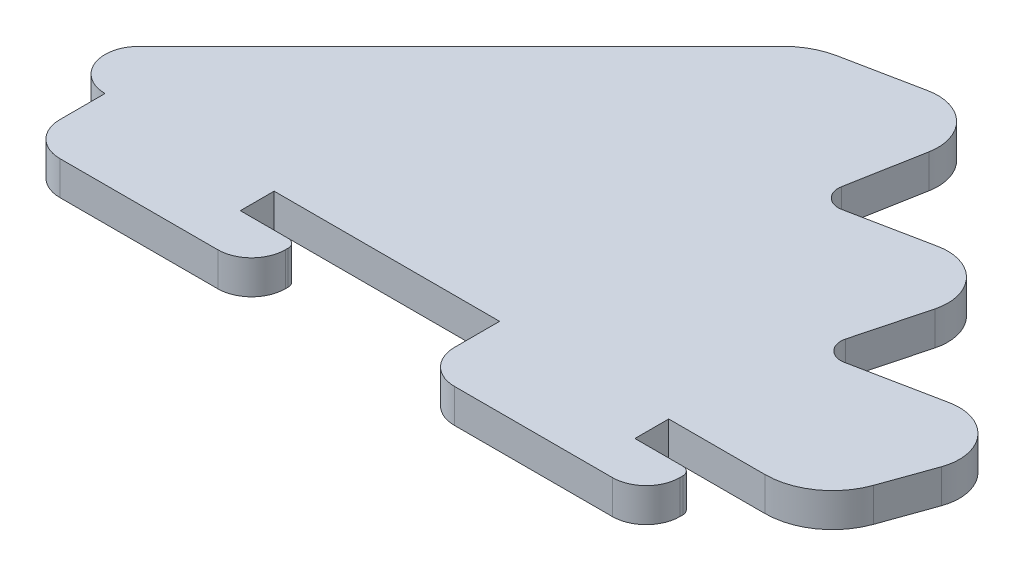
SolidWorks part; units mm, degrees
ref_plane "Front Plane" through (0, 0, 0) normal (0, 0, 1) x (1, 0, 0)
ref_plane "Top Plane" through (0, 0, 0) normal (0, 1, 0) x (1, 0, 0)
ref_plane "Right Plane" through (0, 0, 0) normal (1, 0, 0) x (0, 0, -1)
sketch "Sketch1" plane through (0, 0, 0) normal (0, 1, 0) x (1, 0, 0)
  line L0 (22.2426, 0) -> (42.2426, 0)
  line L1 (-55, 0) -> (55, 0) construction
  line L3 (33.7175, 33.7175) -> (5.1213, 5.1213)
  line L4 (36.7782, 35.3573) -> (43.5415, 36.7163)
  line L5 (48.2644, 32.0759) -> (47.0647, 25.5086)
  line L6 (48.8358, 23.7685) -> (55.9358, 25.1951)
  line L7 (60.5924, 20.2568) -> (58.9457, 13.991)
  line L8 (60.6919, 12.1392) -> (68.4539, 13.6988)
  line L9 (73.0092, 8.4329) -> (71.4215, 3.9835)
  line L10 (57.2426, 0) -> (65.7705, 0)
  line L12 (7.2426, 0) -> (7.2426, -3)
  line L14 (22.2426, 0) -> (22.2426, -3)
  line L15 (22.2426, -3) -> (27.2426, -3)
  line L16 (7.2426, -3) -> (7.2426, -7)
  line L17 (7.2426, -7) -> (27.2426, -7)
  line L18 (27.2426, -3) -> (27.2426, -7)
  line L20 (42.2426, 0) -> (42.2426, -3)
  line L22 (57.2426, 0) -> (57.2426, -3)
  line L23 (57.2426, -3) -> (62.2426, -3)
  line L24 (42.2426, -3) -> (42.2426, -7)
  line L25 (42.2426, -7) -> (62.2426, -7)
  line L26 (62.2426, -3) -> (62.2426, -7)
  arc A3 (68.4539, 13.6988) -> (73.0092, 8.4329) centre (69.2419, 9.7772) cw
  arc A4 (55.9358, 25.1951) -> (60.5924, 20.2568) centre (56.7238, 21.2735) cw
  arc A5 (43.5415, 36.7163) -> (48.2644, 32.0759) centre (44.3295, 32.7947) cw
  arc A6 (33.7175, 33.7175) -> (36.7782, 35.3573) centre (37.9602, 29.4749) cw
  arc A7 (65.7705, 0) -> (71.4215, 3.9835) centre (65.7705, 6) ccw
  arc A8 (7.2426, 0) -> (5.1213, 5.1213) centre (7.2426, 3) cw
  arc A9 (60.6919, 12.1392) -> (58.9457, 13.991) centre (60.3964, 13.6098) cw
  arc A10 (47.0647, 25.5086) -> (48.8358, 23.7685) centre (48.5403, 25.2391) ccw
  point P5 (46.6673, 23.3327)
  point P7 (58.3345, 11.6655)
  point P21 (35, 35)
  point P24 (70, 0)
  point P27 (0, 0)
  point P30 (58.3345, 11.6655)
  point P33 (46.6673, 23.3327)
  point P47 (57.2426, -1.5)
  dimension "D5" = 4
  dimension "D6" = 6
  dimension "D7" = 6
  dimension "D8" = 3
  dimension "D9" = 1.5
  dimension "D1" = 70
  dimension "D2" = 49.4975
  dimension "D3" = 16.5
  dimension "D4" = 16.5
  dimension "D10" = 3
  dimension "D11" = 4
  dimension "D12" = 4
  dimension "D13" = 3
  dimension "D14" = 15
  dimension "D15" = 20
  dimension "D16" = 15
  dimension "D17" = 20
  dimension "D18" = 15
extrude "Boss-Extrude1" add sketch "Sketch1" along normal blind 3
fillet "Fillet1" radius 3 2 edges at (62.2426, 1.5, 7) (27.2426, 1.5, 7)
fillet "Fillet2" radius 0.75 2 edges at (62.2426, 1.5, 3) (27.2426, 1.5, 3)
fillet "Fillet3" radius 3 2 edges at (42.2426, 1.5, 7) (7.2426, 1.5, 7)
